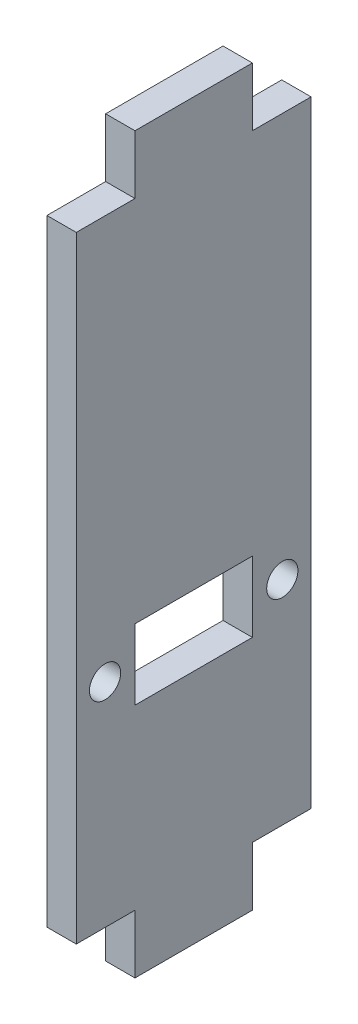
SolidWorks part; units mm, degrees
ref_plane "Front" through (0, 0, 0) normal (0, 0, 1) x (1, 0, 0)
ref_plane "Top" through (0, 0, 0) normal (0, 1, 0) x (1, 0, 0)
ref_plane "Right" through (0, 0, 0) normal (1, 0, 0) x (0, 0, -1)
sketch "Sketch1" plane through (0, 0, 0) normal (1, 0, 0) x (0, 0, -1)
  line L0 (-6.35, 0) -> (-6.35, 6.35)
  line L1 (-12.7, 73.025) -> (-6.35, 73.025)
  line L2 (-12.7, 73.025) -> (-12.7, 6.35)
  line L3 (-6.35, 0) -> (6.35, 0)
  line L4 (0, 0) -> (0, 79.375) construction
  line L5 (-6.35, 6.35) -> (-12.7, 6.35)
  line L6 (6.35, 73.025) -> (6.35, 79.375)
  line L7 (6.35, 6.35) -> (12.7, 6.35)
  line L8 (12.7, 73.025) -> (12.7, 6.35)
  line L9 (12.7, 73.025) -> (6.35, 73.025)
  line L10 (-6.35, 73.025) -> (-6.35, 79.375)
  line L11 (6.35, 0) -> (6.35, 6.35)
  line L12 (-6.35, 79.375) -> (6.35, 79.375)
  line L13 (-12.7, 29.3687) -> (12.7, 29.3687) construction
  line L15 (-6.35, 33.1788) -> (6.35, 33.1788)
  line L16 (-6.35, 33.1788) -> (-6.35, 25.5587)
  line L17 (-6.35, 25.5587) -> (6.35, 25.5587)
  line L18 (6.35, 33.1788) -> (6.35, 25.5587)
  circle A0 centre (-9.5885, 29.3687) radius 1.6891
  circle A1 centre (9.5885, 29.3687) radius 1.6891
  point P25 (-6.35, 29.3687)
  point P26 (0, 33.1788)
  dimension "D4" = 19.177
  dimension "D7" = 3.3782
  dimension "D1" = 12.7
  dimension "D2" = 6.35
  dimension "D3" = 66.675
  dimension "D5" = 23.0188
  dimension "D6" = 6.35
  dimension "D8" = 12.7
  dimension "D9" = 7.62
extrude "Extrude1" add sketch "Sketch1" along normal blind 3.175
